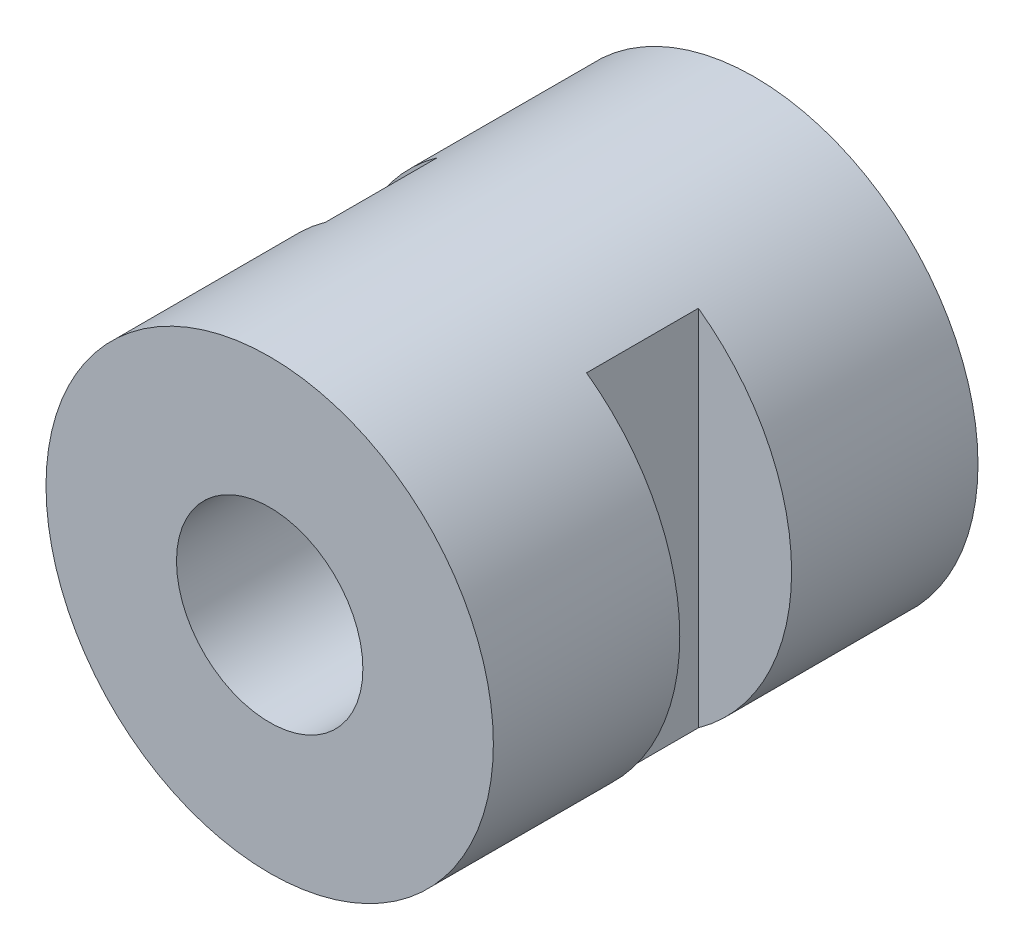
SolidWorks part; units mm, degrees
ref_plane "前视基准面" through (0, 0, 0) normal (0, 0, 1) x (1, 0, 0)
ref_plane "上视基准面" through (0, 0, 0) normal (0, 1, 0) x (1, 0, 0)
ref_plane "右视基准面" through (0, 0, 0) normal (1, 0, 0) x (0, 0, -1)
sketch "草图1" plane through (0, 0, 0) normal (0, 0, 1) x (1, 0, 0)
  circle A0 centre (0, 0) radius 6
extrude "凸台-拉伸1" add sketch "草图1" along normal blind 13
ref_plane "基准面1" through (0, 7.5, 0) normal (0, 1, 0) x (-1, 0, 0)
sketch "草图2" plane through (0, 7.5, 0) normal (0, 1, 0) x (-1, 0, 0)
  line L0 (-6, 13) -> (-6, 0) construction
  line L1 (-6.641, 8) -> (-3.5, 8)
  line L2 (-6.641, 8) -> (-6.641, 5)
  line L3 (-6.641, 5) -> (-3.5, 5)
  line L4 (-3.5, 8) -> (-3.5, 5)
  line L5 (0, 13) -> (0, 0) construction
  line L6 (6, 13) -> (-6, 13) construction
  line L7 (0, 6.5) -> (7.4539, 6.5) construction
  line L10 (6.641, 8) -> (6.641, 5)
  line L11 (6.641, 5) -> (3.5, 5)
  line L12 (3.5, 8) -> (3.5, 5)
  line L13 (6.641, 8) -> (3.5, 8)
  dimension "D1" = 3
  dimension "D2" = 2.5
extrude "切除-拉伸1" cut sketch "草图2" against normal through all
sketch "草图3" plane through (0, 0, 13) normal (0, 0, 1) x (1, 0, 0)
  circle A0 centre (0, 0) radius 2.5
extrude "切除-拉伸2" cut sketch "草图3" against normal blind 13
